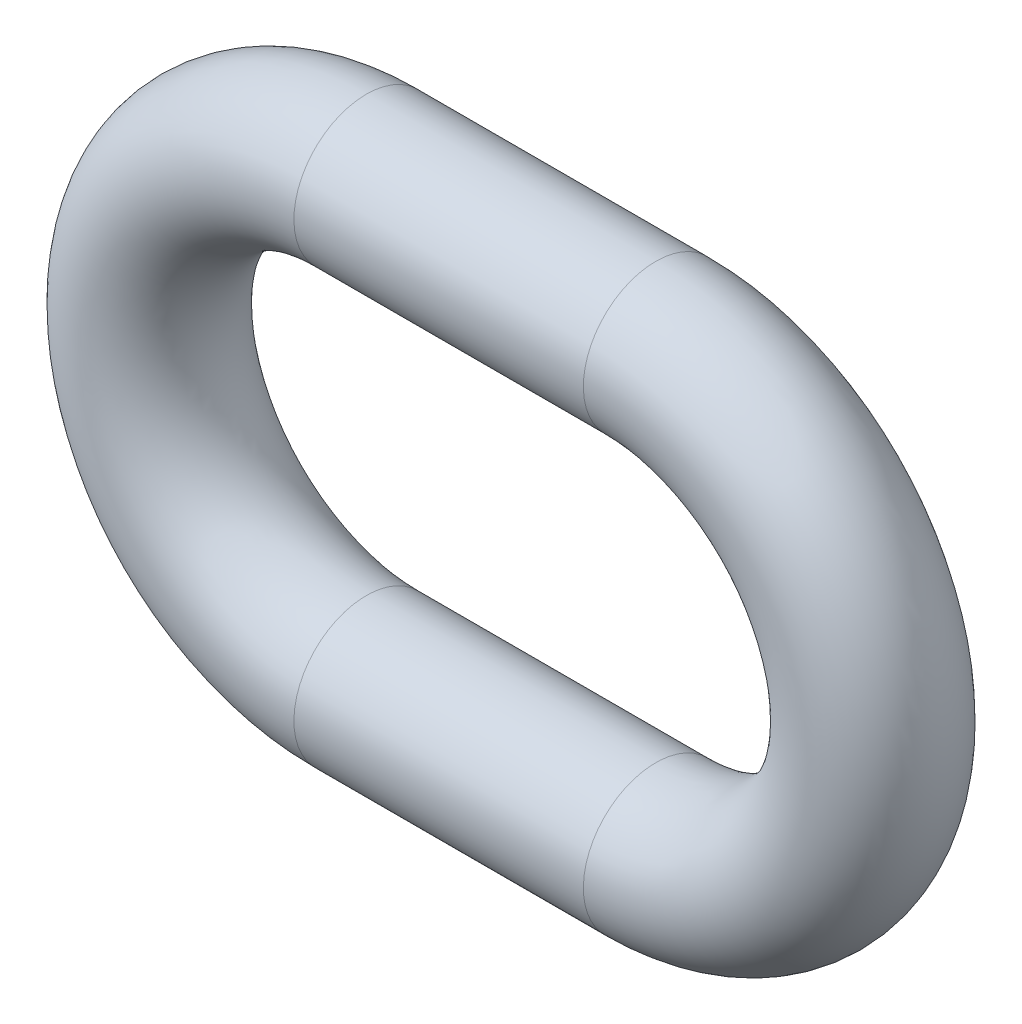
SolidWorks part; units mm, degrees
ref_plane "Ebene vorne" through (0, 0, 0) normal (0, 0, 1) x (1, 0, 0)
ref_plane "Ebene oben" through (0, 0, 0) normal (0, 1, 0) x (1, 0, 0)
ref_plane "Ebene rechts" through (0, 0, 0) normal (1, 0, 0) x (0, 0, -1)
sketch "Kreisquerschnitt" plane through (0, 0, 0) normal (1, 0, 0) x (0, 0, -1)
  circle A1 centre (0, 15) radius 5
  dimension "D1" = 10
sketch "Skizze3" plane through (0, 0, 0) normal (0, 0, 1) x (1, 0, 0)
  line L3 (-10, 0) -> (10, 0) construction
  line L4 (-10, 15) -> (10, 15)
  line L5 (-10, -15) -> (10, -15)
  arc A0 (-10, 15) -> (-10, -15) centre (-10, 0) ccw
  arc A1 (10, -15) -> (10, 15) centre (10, 0) ccw
  point P2 (-10, -15.1763)
  point P7 (0, 0)
  dimension "D1" = 20
  dimension "D2" = 30
sweep "Kettenglied" add profiles "Kreisquerschnitt" path "Skizze3"
